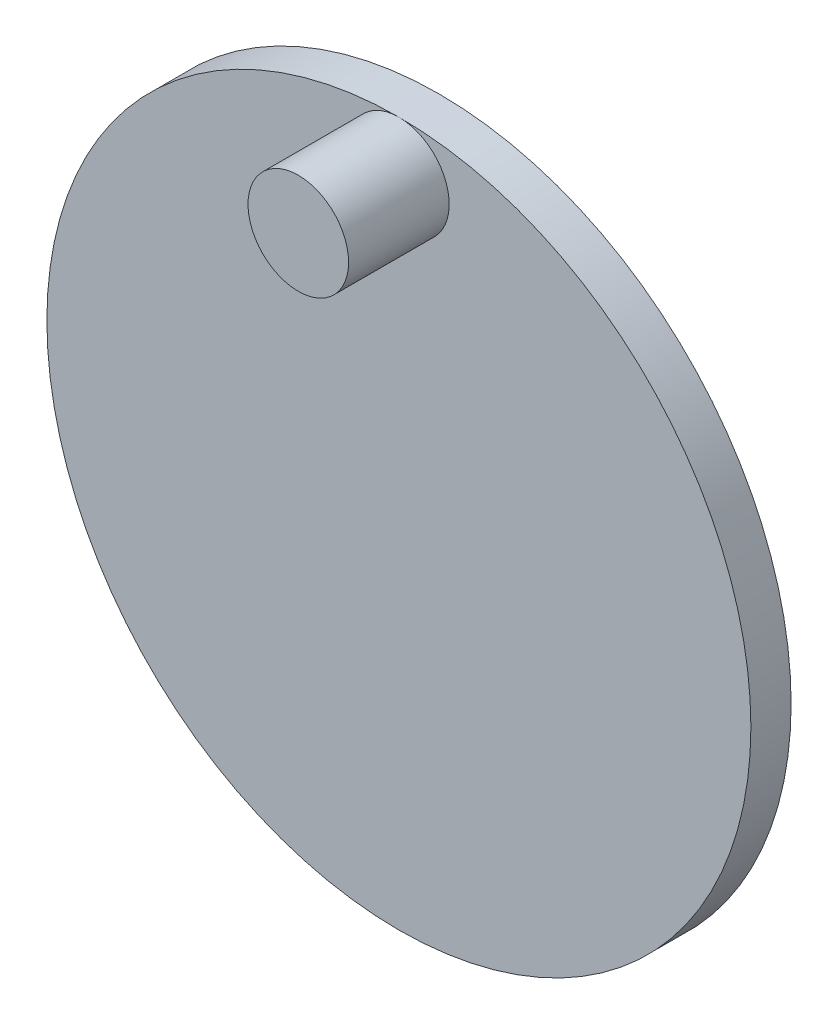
SolidWorks part; units mm, degrees
ref_plane "Front Plane" through (0, 0, 0) normal (0, 0, 1) x (1, 0, 0)
ref_plane "Top Plane" through (0, 0, 0) normal (0, 1, 0) x (1, 0, 0)
ref_plane "Right Plane" through (0, 0, 0) normal (1, 0, 0) x (0, 0, -1)
sketch "Sketch1" plane through (0, 0, 0) normal (0, 0, 1) x (1, 0, 0)
  circle A1 centre (0, 0) radius 17.5
  dimension "D2" = 35
extrude "Boss-Extrude1" add sketch "Sketch1" along normal blind 2
sketch "Sketch2" plane through (0, 0, 0) normal (0, 0, -1) x (-1, 0, 0)
  line L0 (-1.85, 1.9666) -> (1.85, 1.9666)
  line L1 (-1.85, -1.9666) -> (1.85, -1.9666)
  line L2 (0, 1.9666) -> (0, -1.9666) construction
  circle A0 centre (0, 0) radius 2.7
  circle A1 centre (0, 0) radius 3.7
  point P6 (0, 0)
  point P8 (0, 1.9666)
  point P14 (0, -1.9666)
  dimension "D2" = 5.4
  dimension "D3" = 7.4
  dimension "D1" = 3.7
extrude "Boss-Extrude3" add sketch "Sketch2" along normal blind 8 contours A1 A0 | L0 A0 | L1 A0
sketch "Sketch4" plane through (0, 0, 2) normal (0, 0, 1) x (1, 0, 0)
  circle A0 centre (0, 15) radius 2.5
  dimension "D1" = 5
  dimension "D2" = 15
extrude "Boss-Extrude4" add sketch "Sketch4" along normal blind 5
